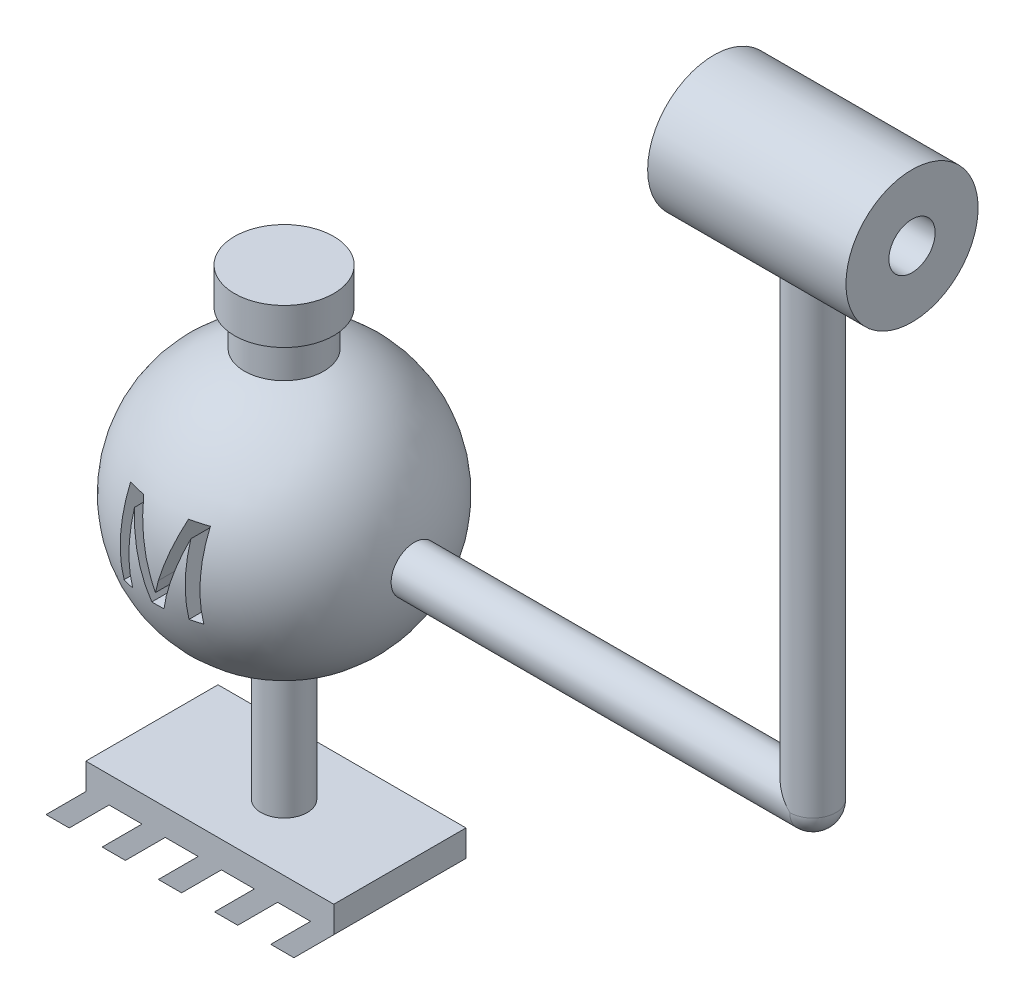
SolidWorks part; units mm, degrees
ref_plane "Face" through (0, 0, 0) normal (0, 0, 1) x (1, 0, 0)
ref_plane "Dessus" through (0, 0, 0) normal (0, 1, 0) x (1, 0, 0)
ref_plane "Droite" through (0, 0, 0) normal (1, 0, 0) x (0, 0, -1)
sketch "Esquisse2" plane through (0, 0, 0) normal (1, 0, 0) x (0, 0, -1)
  line L0 (0, 50.2447) -> (0, -51.0329) construction
  line L1 (0, 30) -> (0, -20)
  line L2 (-6, 24.4829) -> (-6, 19.0788)
  line L5 (-7.5, 24.4829) -> (-6, 24.4829)
  line L6 (-7.5, 24.4829) -> (-7.5, 30)
  line L7 (-7.5, 30) -> (0, 30)
  arc A0 (-6, 19.0788) -> (0, -20) centre (0, 0) ccw
  dimension "D1" = 20
  dimension "D2" = 6
  dimension "D3" = 15
  dimension "D4" = 30
revolve "Révolution1" add sketch "Esquisse2" angle 360 about L0
sketch "Esquisse3" plane through (0, 0, 0) normal (1, 0, 0) x (0, 0, -1)
  circle A0 centre (0, 0) radius 3.5
  dimension "D1" = 7
extrude "Extrusion1" add sketch "Esquisse3" along normal blind 80
sketch "Esquisse4" plane through (0, 0, 0) normal (0, 1, 0) x (1, 0, 0)
  line L0 (80, -3.5) -> (80, 3.5) construction
  circle A0 centre (80, 0) radius 3.5
extrude "Extrusion2" add sketch "Esquisse4" along normal blind 80
sketch "Esquisse5" plane through (0, 0, 0) normal (0, 0, 1) x (1, 0, 0)
  line L0 (80.1927, 80) -> (144.3286, 80) construction
  line L1 (76.5, 80) -> (76.5, 3.5) construction
  line L2 (65, 80) -> (95, 80)
  line L3 (65, 80) -> (65, 70)
  line L4 (65, 70) -> (95, 70)
  line L5 (95, 80) -> (95, 70)
  dimension "D1" = 10
  dimension "D2" = 30
  dimension "D3" = 11.5
revolve "Révolution2" add sketch "Esquisse5" angle 360 about L0
sketch "Esquisse6" plane through (0, 0, 0) normal (0, -1, 0) x (1, 0, 0)
  line L0 (80, 10.4811) -> (80, -12.5849) construction
  line L1 (80, 3.5) -> (80, -3.5)
  line L2 (80, 3.5) -> (80, -3.5)
  arc A1 (80, -3.5) -> (80, 3.5) centre (80, 0) ccw
  arc A2 (80, -3.5) -> (80, 3.5) centre (80, 0) ccw
  dimension "D1" = 0
revolve "Révolution3" add sketch "Esquisse6" angle 360 about L0
sketch "Esquisse7" plane through (95, 0, 0) normal (1, 0, 0) x (0, 0, -1)
  circle A0 centre (0, 80) radius 3.5
  dimension "D1" = 7
extrude "Enlèv. mat.-Extru.1" cut sketch "Esquisse7" against normal blind 35
sketch "Esquisse8" plane through (0, 0, 0) normal (0, 1, 0) x (1, 0, 0)
  circle A0 centre (0, 0) radius 3.5
  dimension "D1" = 7
extrude "Extrusion3" add sketch "Esquisse8" against normal blind 40
sketch "Esquisse9" plane through (0, -40, 0) normal (0, -1, 0) x (1, 0, 0)
  line L1 (20, 10) -> (-20, 10)
  line L2 (20, 10) -> (20, -10)
  line L3 (20, -10) -> (-20, -10)
  line L4 (-20, 10) -> (-20, -10)
  circle A0 centre (0, 0) radius 3.5 construction
  dimension "D1" = 20
  dimension "D2" = 20
  dimension "D3" = 20
  dimension "D4" = 10
extrude "Extrusion4" add sketch "Esquisse9" along normal blind 4
sketch "Esquisse10" plane through (0, 0, 10) normal (0, 0, 1) x (1, 0, 0)
  line L0 (-20, -44) -> (-26.0258, -50.0258)
  line L1 (-26.0258, -50.0258) -> (-22.5129, -50.0258)
  line L2 (-22.5129, -50.0258) -> (-16.4871, -44)
  line L3 (20, -44) -> (-20, -44) construction
  line L4 (-16.4871, -44) -> (-20, -44)
  line L5 (-7.9871, -44) -> (-11.5, -44)
  line L6 (-14.0129, -50.0258) -> (-7.9871, -44)
  line L7 (-17.5258, -50.0258) -> (-14.0129, -50.0258)
  line L8 (-11.5, -44) -> (-17.5258, -50.0258)
  line L9 (0.5129, -44) -> (-3, -44)
  line L10 (-5.5129, -50.0258) -> (0.5129, -44)
  line L11 (-9.0258, -50.0258) -> (-5.5129, -50.0258)
  line L12 (-3, -44) -> (-9.0258, -50.0258)
  line L13 (9.0129, -44) -> (5.5, -44)
  line L14 (2.9871, -50.0258) -> (9.0129, -44)
  line L15 (-0.5258, -50.0258) -> (2.9871, -50.0258)
  line L16 (5.5, -44) -> (-0.5258, -50.0258)
  line L17 (17.5129, -44) -> (14, -44)
  line L18 (11.4871, -50.0258) -> (17.5129, -44)
  line L19 (7.9742, -50.0258) -> (11.4871, -50.0258)
  line L20 (14, -44) -> (7.9742, -50.0258)
extrude "Extrusion5" add sketch "Esquisse10" against normal up to surface (20 mm away)
sketch "Esquisse11" plane through (0, 0, 10) normal (0, 0, 1) x (1, 0, 0)
  line L1 (17.5129, -44) -> (20, -44)
  line L2 (17.5129, -44) -> (17.5129, -40)
  line L3 (17.5129, -40) -> (20, -40)
  line L4 (20, -44) -> (20, -40)
extrude "Enlèv. mat.-Extru.2" cut sketch "Esquisse11" against normal through all
sketch "Esquisse12" plane through (0, 0, 0) normal (0, 0, 1) x (1, 0, 0)
  text T0 "M" font "Arial" height in points 48
extrude "Enlèv. mat.-Extru.3" cut sketch "Esquisse12" along normal blind 73.4549
